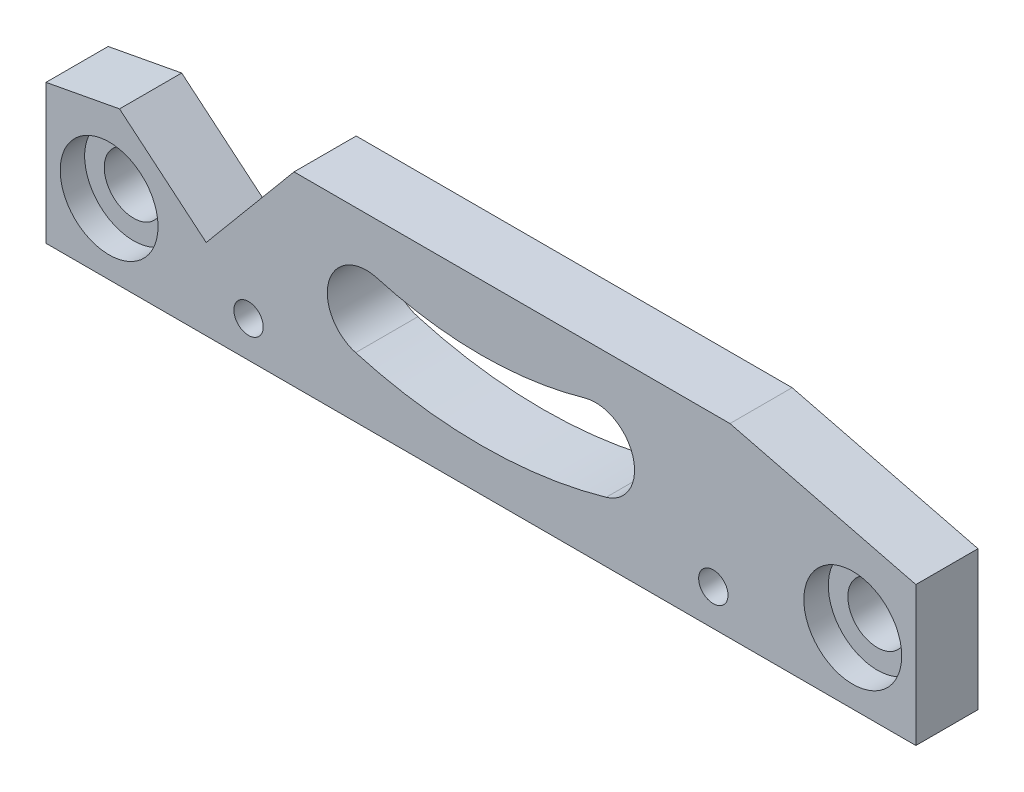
SolidWorks part; units mm, degrees
ref_plane "Front Plane" through (0, 0, 0) normal (0, 0, 1) x (1, 0, 0)
ref_plane "Top Plane" through (0, 0, 0) normal (0, 1, 0) x (1, 0, 0)
ref_plane "Right Plane" through (0, 0, 0) normal (1, 0, 0) x (0, 0, -1)
sketch "Sketch1" plane through (0, 0, 0) normal (0, 0, 1) x (1, 0, 0)
  line L0 (-44.45, 0) -> (44.45, 0)
  line L1 (-44.45, 0) -> (-44.45, 14.25)
  line L2 (44.45, 0) -> (44.45, 14.25)
  line L3 (0, 0) -> (0, 30.3132) construction
  line L4 (-44.45, 14.25) -> (-36.9332, 15.6585)
  line L5 (-36.9332, 15.6585) -> (-28.0779, 8.2577)
  line L6 (44.45, 14.25) -> (25.45, 19)
  line L7 (25.45, 19) -> (-19.1, 19)
  line L9 (-28.0779, 8.2577) -> (-19.1, 19)
  line L10 (-36.9332, 15.6585) -> (-19.1, 19) construction
  dimension "D1" = 88.9
  dimension "D2" = 14.25
  dimension "D3" = 19
  dimension "D4" = 19
  dimension "D5" = 44.55
  dimension "D7" = 14
  dimension "D9" = 129.5
extrude "Boss-Extrude1" add sketch "Sketch1" along normal mid plane 6.35
hole_wizard "CBORE for M6 SBHCS2" positions "Sketch6" profile "Sketch7" counterbore size "M6" standard "ANSI Metric"
sketch "Sketch6" plane through (0, 0, 3.175) normal (0, 0, 1) x (1, 0, 0)
  line L4 (-44.45, 0) -> (44.45, 0) construction
  line L5 (-44.45, 14.25) -> (-44.45, 0) construction
  point P0 (-38, 7.2)
  dimension "D1" = 7.2
  dimension "D2" = 6.45
sketch "Sketch7" plane through (-38, 7.2, 3.175) normal (1, 0, 0) x (0, -1, 0)
  line L0 (0, 0) -> (0, 6.35)
  line L1 (0, 6.35) -> (3, 6.35)
  line L3 (3, 6.35) -> (3, 2.5)
  line L4 (3, 2.5) -> (5, 2.5)
  line L5 (5, 2.5) -> (5, 0)
  line L7 (5, 0) -> (0, 0)
  line L11 (0, -6.35) -> (0, 107.95) construction
  dimension "Thru Hole Dia." = 6
  dimension "Thru Hole Depth" = 6.35
  dimension "C'Bore Dia." = 10
  dimension "C'Bore Depth" = 2.5
mirror "Mirror1" about plane through (0, 0, 0) normal (1, 0, 0) of "CBORE for M6 SBHCS2"
hole_wizard "Ø3.0 (3) Diameter Hole1" positions "Sketch9" profile "Sketch8" hole size "Ø3.0" standard "ANSI Metric"
sketch "Sketch9" plane through (0, 0, 3.175) normal (0, 0, 1) x (1, 0, 0)
  circle A0 centre (-38, 7.2) radius 5 construction
  point P0 (-23.75, 3.7)
  dimension "D1" = 14.25
  dimension "D2" = 3.5
sketch "Sketch8" plane through (-23.75, 3.7, 3.175) normal (1, 0, 0) x (0, -1, 0)
  line L0 (0, 0) -> (0, 6.35)
  line L1 (0, 6.35) -> (1.5, 6.35)
  line L2 (1.5, 6.35) -> (1.5, 0)
  line L5 (1.5, 0) -> (0, 0)
  line L11 (0, -6.35) -> (0, 107.95) construction
  dimension "Thru Hole Dia." = 3
  dimension "Thru Hole Depth" = 6.35
mirror "Mirror2" about plane through (0, 0, 0) normal (1, 0, 0) of "Ø3.0 (3) Diameter Hole1"
sketch "Sketch10" plane through (0, 0, 3.175) normal (0, 0, 1) x (1, 0, 0)
  line L0 (0, 0) -> (0, 48.0329) construction
  line L3 (-44.45, 0) -> (44.45, 0) construction
  arc A0 (11.7008, 9.9944) -> (-11.7008, 9.9944) centre (0, 50.8) cw construction
  arc A1 (-12.8034, 6.1494) -> (12.8034, 6.1494) centre (0, 50.8) ccw
  arc A2 (-10.5983, 13.8395) -> (10.5983, 13.8395) centre (0, 50.8) ccw
  arc A3 (-10.5983, 13.8395) -> (-12.8034, 6.1494) centre (-11.7008, 9.9944) ccw
  arc A4 (12.8034, 6.1494) -> (10.5983, 13.8395) centre (11.7008, 9.9944) ccw
  point P3 (0, 8.35)
  dimension "D1" = 4
  dimension "D3" = 42.45
  dimension "D4" = 8.35
  dimension "D2" = 32
extrude "Cut-Extrude1" cut sketch "Sketch10" against normal up to next
